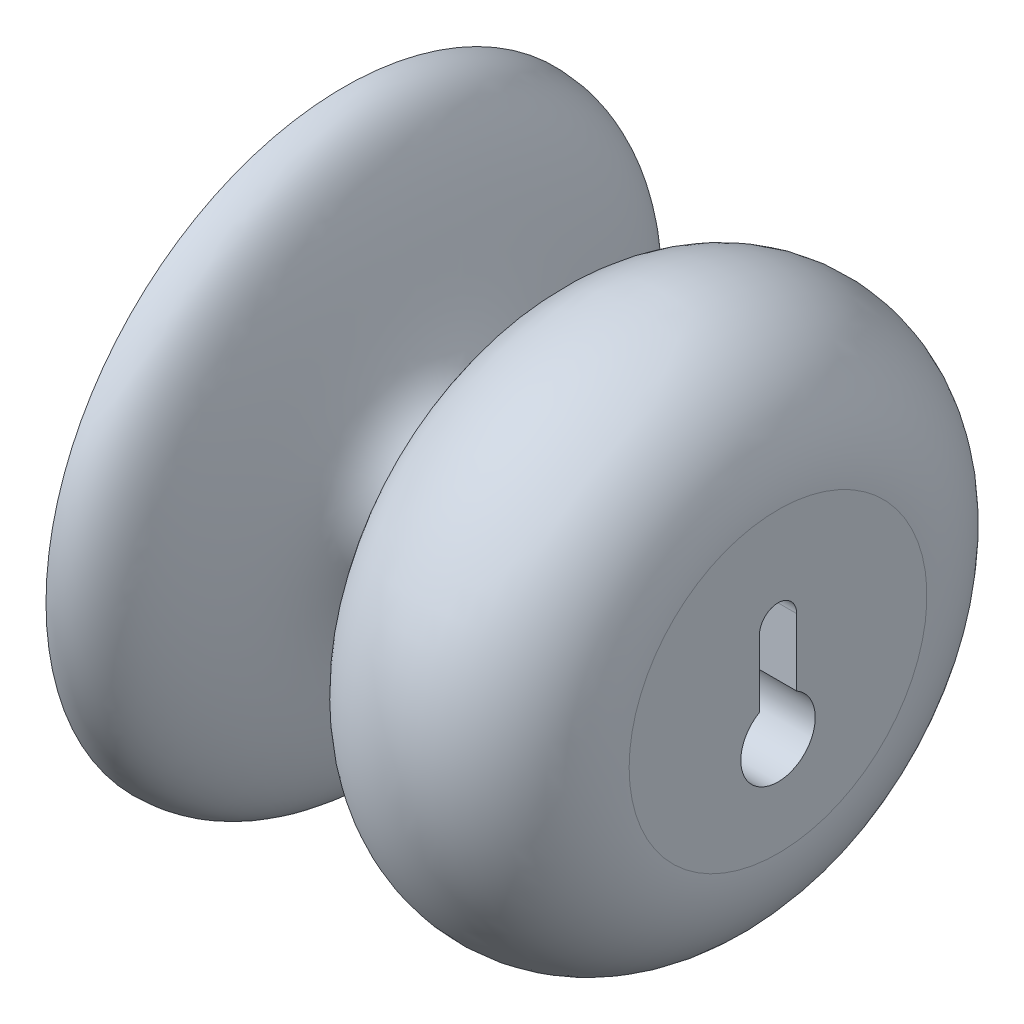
SolidWorks part; units mm, degrees
ref_plane "Front Plane" through (0, 0, 0) normal (0, 0, 1) x (1, 0, 0)
ref_plane "Top Plane" through (0, 0, 0) normal (0, 1, 0) x (1, 0, 0)
ref_plane "Right Plane" through (0, 0, 0) normal (1, 0, 0) x (0, 0, -1)
sketch "Sketch1" plane through (0, 0, 0) normal (0, 0, 1) x (1, 0, 0)
  line L0 (-44.45, 0) -> (0, 0)
  line L1 (0, 0) -> (0, 15.24)
  line L2 (-44.45, 30.48) -> (-57.3005, 30.48) construction
  line L3 (-25.4, 15.24) -> (-25.4, 6.35)
  line L4 (-44.45, 0) -> (-44.45, 30.48)
  line L5 (-25.4, 6.35) -> (-15.848, 6.35) construction
  arc A0 (-25.4, 15.24) -> (0, 15.24) centre (-12.7, 15.24) cw
  spline S0 degree 3 poles (-44.45, 30.48) (-39.1654, 30.48) (-37.2171, 19.5472) (-35.0907, 8.9865) (-29.5219, 6.35) (-25.4, 6.35) knots 0 0 0 0 0.455503 0.702535 1 1 1 1
  point P7 (-25.4, 6.35)
  dimension "D1" = 15.24
  dimension "D2" = 25.4
  dimension "D3" = 30.48
  dimension "D4" = 19.05
  dimension "D5" = 6.35
  dimension "D6" = 12.7
  dimension "D7" = 20.32
  dimension "D8" = 7.62
  dimension "D9" = 10.16
revolve "Revolve1" add sketch "Sketch1" angle 360 about L0
sketch "Sketch21" plane through (0, 1.248, 1.8481) normal (1, 0, 0) x (0, 0, -1)
  line L0 (1.8481, 3.832) -> (1.8481, -6.328) construction
  line L1 (3.7531, 3.832) -> (3.7531, -6.328)
  line L2 (-0.0569, 3.832) -> (-0.0569, -6.328)
  arc A0 (3.7531, 3.832) -> (-0.0569, 3.832) centre (1.8481, 3.832) ccw
  arc A1 (-0.0569, -6.328) -> (3.7531, -6.328) centre (1.8481, -6.328) ccw
  circle A2 centre (1.8481, -6.328) radius 3.81
  circle A3 centre (1.8481, -1.248) radius 15.24 construction
  point P3 (1.8481, -1.248)
  dimension "D3" = 7.62
  dimension "D1" = 10.16
  dimension "D2" = 3.81
extrude "Cut-Extrude1" cut sketch "Sketch21" against normal blind 25.4
other "Filleted Keyway<1>"
